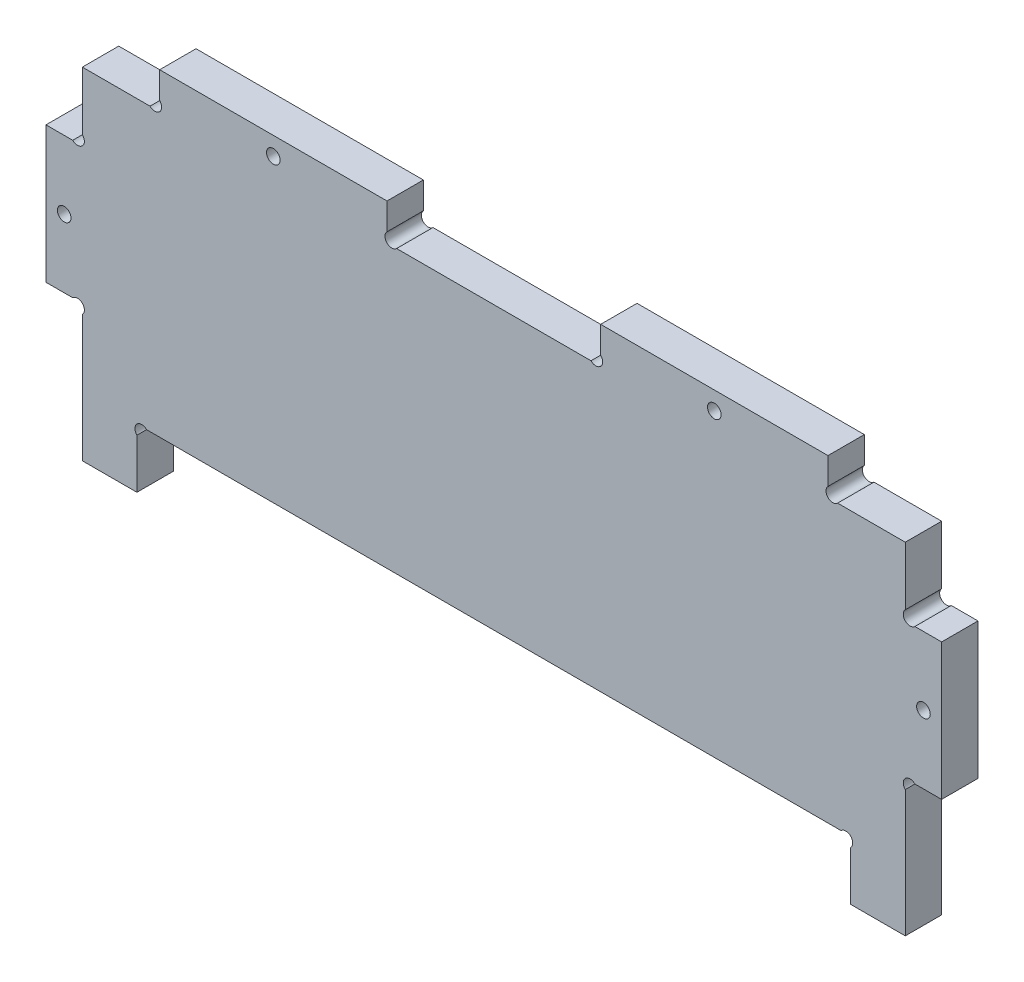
SolidWorks part; units mm, degrees
ref_plane "Plan de face" through (0, 0, 0) normal (0, 0, 1) x (1, 0, 0)
ref_plane "Plan de dessus" through (0, 0, 0) normal (0, 1, 0) x (1, 0, 0)
ref_plane "Plan de droite" through (0, 0, 0) normal (1, 0, 0) x (0, 0, -1)
sketch "Esquisse1" plane through (0, 0, 0) normal (0, 0, 1) x (1, 0, 0)
  line L0 (-46.1644, 25.4633) -> (145.8356, -36.5367) construction
  line L1 (56.8356, 44.3822) -> (56.8356, -71.661) construction
  line L2 (-21.0431, -36.5367) -> (24.7143, -36.5367)
  line L3 (145.8356, -22.0974) -> (145.8356, -21.658)
  line L4 (147.9569, -19.5367) -> (153.8356, -19.5367)
  line L5 (83.8356, -36.5367) -> (153.8356, -36.5367) construction
  line L6 (145.8356, -36.5367) -> (145.8356, -19.5367) construction
  line L7 (-35.1644, -36.5367) -> (-35.1644, -49.5367)
  line L8 (-43.1644, 10.4633) -> (-35.1644, -19.5367) construction
  line L9 (-23.1644, -36.5367) -> (-5.1366, -54.5645) construction
  line L10 (133.8356, -36.5367) -> (112.2756, -58.0967) construction
  line L11 (128.8356, 25.4633) -> (140.0883, 36.716) construction
  line L12 (-18.1644, 33.4633) -> (31.8356, 25.4633) construction
  line L13 (156.8356, 25.4633) -> (-35.1644, -36.5367) construction
  line L14 (-20.2857, 25.4633) -> (-35.1644, 25.4633)
  line L15 (-18.1644, 33.4633) -> (-18.1644, 27.5846)
  line L16 (31.8356, 33.4633) -> (-18.1644, 33.4633)
  line L17 (31.8356, 27.5846) -> (31.8356, 33.4633)
  line L18 (153.8356, -19.5367) -> (153.8356, 10.4633)
  line L19 (145.8356, 13.0239) -> (145.8356, 25.4633)
  line L20 (145.8356, -36.5367) -> (145.8356, -22.0974)
  line L21 (153.8356, 10.4633) -> (147.9569, 10.4633)
  line L22 (-35.1644, 12.5846) -> (-35.1644, 13.0239)
  line L23 (-43.1644, 10.4633) -> (-37.2857, 10.4633)
  line L24 (-35.1644, -36.5367) -> (-35.1644, -22.0974)
  line L25 (-35.1644, 13.0239) -> (-35.1644, 25.4633)
  line L26 (145.8356, 12.5846) -> (145.8356, 13.0239)
  line L27 (128.8356, 33.4633) -> (78.8356, 25.4633) construction
  line L28 (-43.1644, -19.5367) -> (-43.1644, 10.4633)
  line L29 (-46.1644, 33.4633) -> (153.8356, 33.4633) construction
  line L30 (24.7143, -36.5367) -> (131.7143, -36.5367)
  line L31 (-35.1644, -49.5367) -> (-23.1644, -49.5367)
  line L32 (-37.2857, -19.5367) -> (-43.1644, -19.5367)
  line L33 (78.8356, 27.5846) -> (78.8356, 33.4633)
  line L34 (78.8356, 33.4633) -> (128.8356, 33.4633)
  line L35 (128.8356, 33.4633) -> (128.8356, 27.5846)
  line L36 (130.9569, 25.4633) -> (145.8356, 25.4633)
  line L37 (153.8356, 10.4633) -> (145.8356, -19.5367) construction
  line L38 (-18.1644, 25.4633) -> (-24.3101, 31.609) construction
  line L39 (145.8356, 33.4633) -> (145.8356, 27.5846) construction
  line L41 (53.8356, 44.3822) -> (53.8356, -71.661) construction
  line L42 (-35.1644, -22.0974) -> (-35.1644, -21.658)
  line L43 (55.3356, 42.6899) -> (55.3356, -74.3203) construction
  line L45 (76.7143, 25.4633) -> (33.9569, 25.4633)
  line L47 (-23.1644, -49.5367) -> (-23.1644, -38.658)
  line L48 (145.8356, -36.5367) -> (145.8356, -49.5367)
  line L49 (145.8356, -49.5367) -> (133.8356, -49.5367)
  line L50 (133.8356, -49.5367) -> (133.8356, -38.658)
  circle A0 centre (-39.1644, -4.5367) radius 1.5
  arc A1 (-21.0431, -36.5367) -> (-23.1644, -38.658) centre (-22.1037, -37.5974) ccw
  circle A2 centre (6.8356, 29.4633) radius 1.5
  arc A3 (133.8356, -38.658) -> (131.7143, -36.5367) centre (132.7749, -37.5974) ccw
  arc A4 (128.8356, 27.5846) -> (130.9569, 25.4633) centre (129.8963, 26.5239) ccw
  arc A5 (33.9569, 25.4633) -> (31.8356, 27.5846) centre (32.8963, 26.5239) cw
  arc A6 (-35.1644, 12.5846) -> (-37.2857, 10.4633) centre (-36.2251, 11.5239) cw
  arc A7 (147.9569, -19.5367) -> (145.8356, -21.658) centre (146.8963, -20.5974) ccw
  arc A8 (145.8356, 12.5846) -> (147.9569, 10.4633) centre (146.8963, 11.5239) ccw
  arc A9 (-37.2857, -19.5367) -> (-35.1644, -21.658) centre (-36.2251, -20.5974) cw
  arc A10 (-20.2857, 25.4633) -> (-18.1644, 27.5846) centre (-19.2251, 26.5239) ccw
  arc A11 (76.7143, 25.4633) -> (78.8356, 27.5846) centre (77.7749, 26.5239) ccw
  circle A15 centre (103.8356, 29.4633) radius 1.5
  circle A16 centre (149.8356, -4.5367) radius 1.5
  dimension "D3" = 45
  dimension "D7" = 12
  dimension "D2" = 50
  dimension "D1" = 45
  dimension "D9" = 45
  dimension "D6" = 1.5
  dimension "D5" = 12
  dimension "D4" = 45
  dimension "D8" = 17
extrude "Boss.-Extru.1" add sketch "Esquisse1" along normal blind 8
